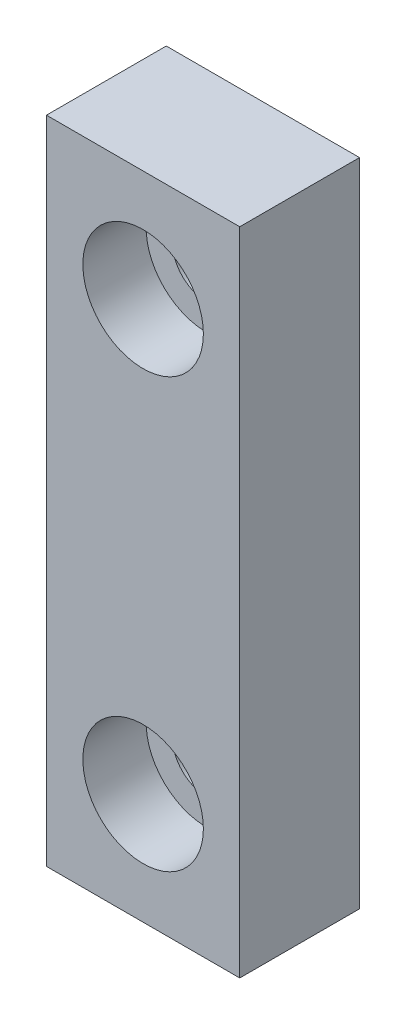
SolidWorks part; units mm, degrees
ref_plane "Front/Back" through (0, 0, 0) normal (0, 0, 1) x (1, 0, 0)
ref_plane "Top/Bottom" through (0, 0, 0) normal (0, 1, 0) x (1, 0, 0)
ref_plane "Right/Left" through (0, 0, 0) normal (1, 0, 0) x (0, 0, -1)
sketch "Sketch1" plane through (0, 0, 0) normal (0, 0, 1) x (1, 0, 0)
  line L0 (0, 0) -> (6.4135, 0) construction
  line L1 (-6.4135, 21.59) -> (6.4135, 21.59)
  line L2 (-6.4135, 21.59) -> (-6.4135, -21.59)
  line L3 (-6.4135, -21.59) -> (6.4135, -21.59)
  line L4 (6.4135, 21.59) -> (6.4135, -21.59)
  line L5 (0, 0) -> (0, 21.59) construction
  dimension "D1" = 12.827
  dimension "D2" = 43.18
extrude "Extrude1" add sketch "Sketch1" along normal mid plane 7.9502
hole_wizard "CBORE for M4 SHCS1" positions "Sketch3" profile "Sketch2" counterbore size "M4" standard "Ansi Metric"
sketch "Sketch3" plane through (0, 0, 3.9751) normal (0, 0, 1) x (1, 0, 0)
  line L0 (0, 0) -> (0, 36.8877) construction
  line L1 (0, 0) -> (26.0835, 0) construction
  point P0 (0, 14.224)
  point P1 (0, -14.224)
  dimension "D1" = 28.448
sketch "Sketch2" plane through (0, 14.224, 3.9751) normal (1, 0, 0) x (0, -1, 0)
  line L0 (0, 0) -> (0, 7.9502)
  line L1 (0, 7.9502) -> (2.25, 7.9502)
  line L3 (2.25, 7.9502) -> (2.25, 4.2)
  line L4 (2.25, 4.2) -> (4, 4.2)
  line L5 (4, 4.2) -> (4, 0)
  line L7 (4, 0) -> (0, 0)
  line L11 (0, -6.35) -> (0, 107.95) construction
  dimension "Thru Hole Dia." = 4.5
  dimension "Thru Hole Depth" = 7.9502
  dimension "C'Bore Dia." = 8
  dimension "C'Bore Depth" = 4.2
